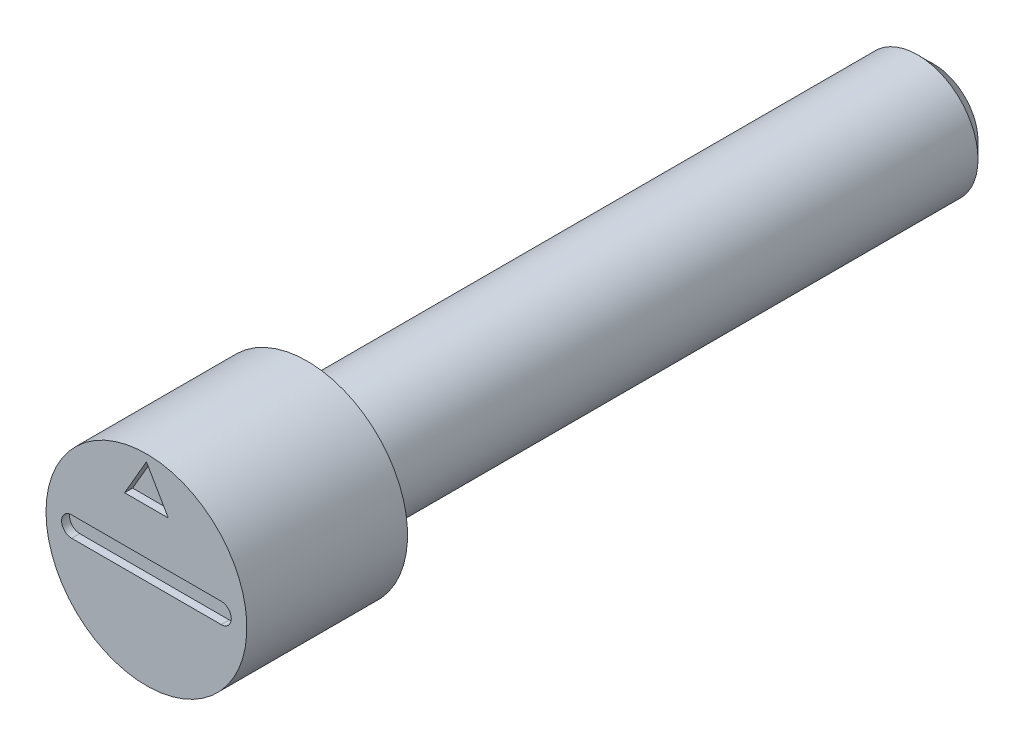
SolidWorks part; units mm, degrees
ref_plane "Front Plane" through (0, 0, 0) normal (0, 0, 1) x (1, 0, 0)
ref_plane "Top Plane" through (0, 0, 0) normal (0, 1, 0) x (1, 0, 0)
ref_plane "Right Plane" through (0, 0, 0) normal (1, 0, 0) x (0, 0, -1)
imported_body "Imported1"
other "DeleteFace1"
sketch "Sketch1" plane through (0, 0, 0) normal (0, 0, 1) x (1, 0, 0)
  line L0 (0, 1.1642) -> (-0.2715, 0.6939)
  line L1 (-0.2715, 0.6939) -> (0.2715, 0.6939)
  line L2 (0.2715, 0.6939) -> (0, 1.1642)
  line L4 (-0.93, 0.126) -> (0.93, 0.126)
  line L6 (-0.93, -0.126) -> (0.93, -0.126)
  arc A0 (-0.93, 0.126) -> (-0.93, -0.126) centre (-0.93, 0) ccw
  arc A1 (0.93, -0.126) -> (0.93, 0.126) centre (0.93, 0) ccw
  dimension "D7" = 2.112
  dimension "D8" = 1.056
  dimension "D1" = 60
  dimension "D2" = 60
  dimension "D3" = 0.543
  dimension "D4" = 0.6939
  dimension "D5" = 0.252
  dimension "D6" = 0.126
extrude "Cut-Extrude1" cut sketch "Sketch1" against normal blind 0.1
sketch "Sketch2" plane through (0, 0, 0) normal (0, 1, 0) x (1, 0, 0)
  line L0 (0.75, 2) -> (0.75, 13) construction
  line L1 (-0.75, 13) -> (0.75, 13)
  line L2 (-0.75, 13) -> (-0.75, 9.8)
  line L3 (-0.75, 9.8) -> (0.75, 9.8)
  line L4 (0.75, 13) -> (0.75, 9.8)
  dimension "D1" = 9.8
extrude "Cut-Extrude2" cut sketch "Sketch2" against normal through all both and the other way through all
chamfer "Chamfer1" distance 0.2 angle 45 1 edges at (0.75, 0, -9.8)
